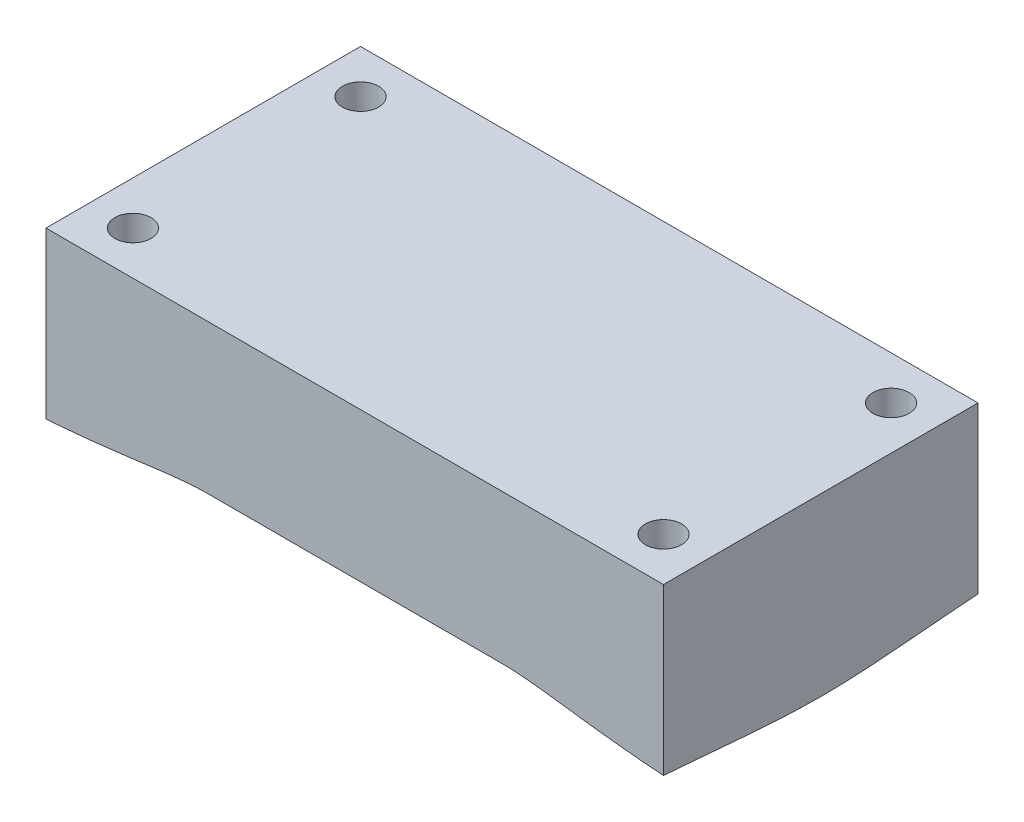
SolidWorks part; units mm, degrees
ref_plane "Front Plane" through (0, 0, 0) normal (0, 0, 1) x (1, 0, 0)
ref_plane "Top Plane" through (0, 0, 0) normal (0, 1, 0) x (1, 0, 0)
ref_plane "Right Plane" through (0, 0, 0) normal (1, 0, 0) x (0, 0, -1)
body saved out of another part "Stock-Handle Battery Cover-1"
sketch "Contain" plane through (0, 139.3607, 0) normal (0, 1, 0) x (1, 0, 0)
  line L2 (-40, -11.5) -> (40, -11.5)
  line L3 (40, 11.5) -> (-40, 11.5)
  line L4 (-40, -11.5) -> (40, -11.5)
  line L5 (40, 11.5) -> (-40, 11.5)
  spline S2 degree 3 poles (-351.8718, 2994.8506) (-12.4936, -13.0974) (-28.0021, 12.0056) (-40.6179, 11.4849) (-40.9279, 11.4644) (-41.3298, 11.4267) (-41.8273, 11.36) (-42.5694, 11.2211) (-43.4798, 10.9798) (-44.8241, 10.4818) (-46.3759, 9.6478) (-48.0076, 8.3432) (-49.4256, 6.7099) (-50.566, 4.7411) (-51.3155, 2.4581) (-51.5934, -0.0167) (-51.3107, -2.4866) (-50.5646, -4.7335) (-49.433, -6.7045) (-48.0004, -8.3531) (-46.3516, -9.6681) (-44.7963, -10.4926) (-43.4711, -10.9822) (-42.554, -11.2239) (-41.7947, -11.3646) (-41.1882, -11.4428) (-25.5964, -12.7012) (-1.2059, 25.6268) (-662.0402, -2945.9933) knots -0.938337 -0.938337 -0.938337 -0.938337 0.007797 0.015645 0.023576 0.031617 0.046877 0.063025 0.092544 0.125717 0.187969 0.250504 0.312765 0.375376 0.437987 0.500502 0.562782 0.625115 0.68558 0.750086 0.814132 0.874663 0.907691 0.937221 0.953993 0.969928 0.985199 2.155293 2.155293 2.155293 2.155293 only from (-40, 11.5) to (-40, -11.5)
  spline S3 degree 3 poles (348.4279, -2995.4279) (12.4282, 13.0572) (27.9528, -12.0032) (40.6186, -11.485) (40.9285, -11.4647) (41.3303, -11.4272) (41.8277, -11.3608) (42.5688, -11.2222) (43.4786, -10.9806) (44.8225, -10.4824) (46.3754, -9.6481) (48.0073, -8.3435) (49.4254, -6.7103) (50.5658, -4.7415) (51.3154, -2.4584) (51.5934, 0.0164) (51.3108, 2.4864) (50.5646, 4.7334) (49.4331, 6.7045) (48.0005, 8.353) (46.3516, 9.668) (44.7964, 10.4925) (43.4711, 10.9822) (42.554, 11.2239) (41.7947, 11.3646) (41.1882, 11.4428) (25.5969, 12.7012) (1.2069, -25.6256) (662.0474, 2945.936) knots -0.94206 -0.94206 -0.94206 -0.94206 0.007813 0.015667 0.023592 0.031617 0.046883 0.063022 0.092453 0.12571 0.187965 0.2505 0.312763 0.375375 0.437986 0.500501 0.562784 0.625117 0.685583 0.75009 0.814132 0.874665 0.907692 0.937223 0.953994 0.969929 0.985199 2.155237 2.155237 2.155237 2.155237 only from (40, -11.5) to (40, 11.5)
  spline S4 degree 3 poles (-40, 11.5) (-40.1027, 11.4992) (-40.3087, 11.4976) (-40.6179, 11.4849) (-40.9279, 11.4644) (-41.3298, 11.4267) (-41.8273, 11.36) (-42.5694, 11.2211) (-43.4798, 10.9798) (-44.8241, 10.4818) (-46.3759, 9.6478) (-48.0076, 8.3432) (-49.4256, 6.7099) (-50.566, 4.7411) (-51.3155, 2.4581) (-51.5934, -0.0167) (-51.3107, -2.4866) (-50.5646, -4.7335) (-49.433, -6.7045) (-48.0004, -8.3531) (-46.3516, -9.6681) (-44.7963, -10.4926) (-43.4711, -10.9822) (-42.554, -11.2239) (-41.7947, -11.3646) (-41.1882, -11.4428) (-40.5911, -11.491) (-40.195, -11.497) (-40, -11.5) knots 0 0 0 0 0.007797 0.015645 0.023576 0.031617 0.046877 0.063025 0.092544 0.125717 0.187969 0.250504 0.312765 0.375376 0.437987 0.500502 0.562782 0.625115 0.68558 0.750086 0.814132 0.874663 0.907691 0.937221 0.953993 0.969928 0.985199 1 1 1 1
  spline S5 degree 3 poles (40, -11.5) (40.1029, -11.4992) (40.3092, -11.4977) (40.6186, -11.485) (40.9285, -11.4647) (41.3303, -11.4272) (41.8277, -11.3608) (42.5688, -11.2222) (43.4786, -10.9806) (44.8225, -10.4824) (46.3754, -9.6481) (48.0073, -8.3435) (49.4254, -6.7103) (50.5658, -4.7415) (51.3154, -2.4584) (51.5934, 0.0164) (51.3108, 2.4864) (50.5646, 4.7334) (49.4331, 6.7045) (48.0005, 8.353) (46.3516, 9.668) (44.7964, 10.4925) (43.4711, 10.9822) (42.554, 11.2239) (41.7947, 11.3646) (41.1882, 11.4428) (40.591, 11.491) (40.195, 11.497) (40, 11.5) knots 0 0 0 0 0.007813 0.015667 0.023592 0.031617 0.046883 0.063022 0.092453 0.12571 0.187965 0.2505 0.312763 0.375375 0.437986 0.500501 0.562784 0.625117 0.685583 0.75009 0.814132 0.874665 0.907692 0.937223 0.953994 0.969929 0.985199 1 1 1 1
  dimension "D1" = 0
